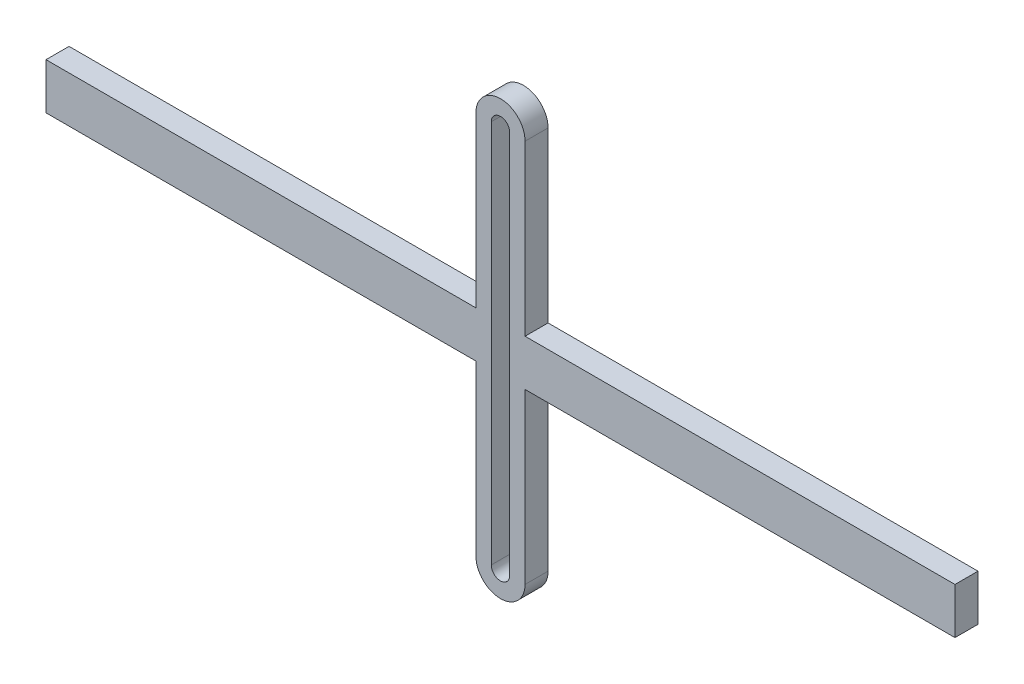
SolidWorks part; units mm, degrees
ref_plane "Front Plane" through (0, 0, 0) normal (0, 0, 1) x (1, 0, 0)
ref_plane "Top Plane" through (0, 0, 0) normal (0, 1, 0) x (1, 0, 0)
ref_plane "Right Plane" through (0, 0, 0) normal (1, 0, 0) x (0, 0, -1)
sketch "Sketch2" plane through (0, 0, 0) normal (0, 0, 1) x (1, 0, 0)
  line L0 (0, -62.5) -> (0, 62.5) construction
  line L1 (-3, -62.5) -> (-3, 62.5)
  line L2 (3, -62.5) -> (3, 62.5)
  line L3 (-8, -62.5) -> (-8, 62.5)
  line L4 (8, -62.5) -> (8, 62.5)
  line L5 (0, 0) -> (8, 0) construction
  arc A0 (-3, -62.5) -> (3, -62.5) centre (0, -62.5) ccw
  arc A1 (3, 62.5) -> (-3, 62.5) centre (0, 62.5) ccw
  arc A2 (8, 62.5) -> (-8, 62.5) centre (0, 62.5) ccw
  arc A3 (-8, -62.5) -> (8, -62.5) centre (0, -62.5) ccw
  point P2 (0, 0)
  dimension "D1" = 6
  dimension "D2" = 125
  dimension "D3" = 5
extrude "Boss-Extrude1" add sketch "Sketch2" along normal blind 7.5
sketch "Sketch5" plane through (8, 0, 0) normal (1, 0, 0) x (0, 0, -1)
  line L0 (-7.5, 62.5) -> (0, -62.5) construction
  line L1 (0, 62.5) -> (-7.5, -62.5) construction
  line L2 (0, -62.5) -> (0, 62.5) construction
  line L3 (-7.5, 7.5) -> (0, 7.5)
  line L4 (-7.5, 7.5) -> (-7.5, -7.5)
  line L5 (-7.5, -7.5) -> (0, -7.5)
  line L6 (0, 7.5) -> (0, -7.5)
  line L7 (-7.5, 7.5) -> (0, -7.5) construction
  line L8 (-7.5, -7.5) -> (0, 7.5) construction
  point P8 (-3.75, 0)
  dimension "D1" = 15
extrude "Boss-Extrude3" add sketch "Sketch5" along normal blind 140
mirror "Mirror1" about plane through (0, 0, 0) normal (1, 0, 0) of "Boss-Extrude3"
